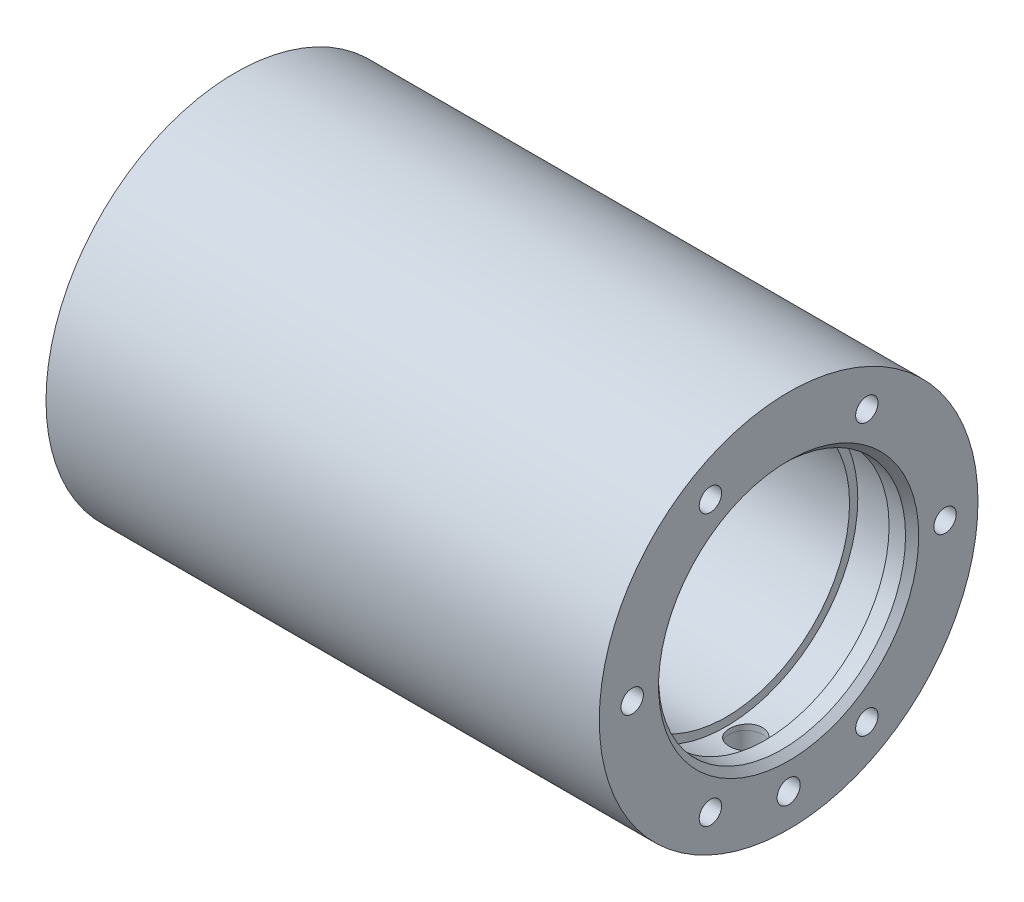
SolidWorks part; units mm, degrees
ref_plane "前视基准面" through (0, 0, 0) normal (0, 0, 1) x (1, 0, 0)
ref_plane "上视基准面" through (0, 0, 0) normal (0, 1, 0) x (1, 0, 0)
ref_plane "右视基准面" through (0, 0, 0) normal (1, 0, 0) x (0, 0, -1)
sketch "草图1" plane through (0, 0, 0) normal (0, 0, 1) x (1, 0, 0)
  line L0 (0, 37.5) -> (16, 37.5)
  line L1 (16, 37.5) -> (16, 40)
  line L2 (16, 40) -> (28, 40)
  line L3 (28, 40) -> (28, 37.5)
  line L4 (28, 37.5) -> (149, 37.5)
  line L5 (149, 37.5) -> (149, 40)
  line L6 (149, 40) -> (161, 40)
  line L7 (161, 40) -> (161, 37.5)
  line L8 (161, 37.5) -> (168, 37.5)
  line L9 (168, 37.5) -> (168, 57.5)
  line L10 (168, 57.5) -> (0, 57.5)
  line L11 (0, 57.5) -> (0, 37.5)
  line L12 (0, 0) -> (-13.8002, 0) construction
  dimension "D1" = 75
  dimension "D2" = 80
  dimension "D3" = 168
  dimension "D4" = 115
  dimension "D5" = 16
  dimension "D6" = 12
  dimension "D7" = 7
  dimension "D8" = 12
revolve "旋转1" add sketch "草图1" angle 360 about L12
chamfer "倒角1" distance 2 angle 45 2 edges at (0, 0, -37.5) (168, 0, -37.5)
sketch "草图2" plane through (0, 0, 0) normal (1, 0, 0) x (0, 0, -1)
  line L0 (0, 0) -> (-6.4772, 0) construction
  circle A0 centre (0, -47.5) radius 3.5
  dimension "D2" = 7
  dimension "D1" = 95
extrude "切除-拉伸2" cut sketch "草图2" along normal blind 22
sketch "草图4" plane through (0, 0, 0) normal (0, 0, 1) x (1, 0, 0)
  line L0 (22, -57.5) -> (22, -76.559) construction
  line L1 (0, -57.5) -> (168, -57.5) construction
  line L2 (16.5, -57.5) -> (17, -41.5)
  line L3 (17, -36.3885) -> (22, -36.3885)
  line L4 (17, -41.5) -> (17, -36.3885)
  line L5 (16.5, -57.5) -> (22, -57.5)
  line L6 (22, -57.5) -> (22, -36.3885)
  line L10 (0, 57.5) -> (0, -57.5) construction
  point P3 (17, -41.5)
  dimension "D1" = 11
  dimension "D2" = 22
  dimension "D3" = 16
  dimension "D4" = 10
revolve "NPT1/4" cut sketch "草图4" angle 360 about L0
sketch "草图5" plane through (0, 0, 0) normal (0, 0, 1) x (1, 0, 0)
  line L0 (155, -13.9183) -> (155, -63.9266) construction
  line L1 (155, -32.6835) -> (155, -57.5)
  line L2 (155, -57.5) -> (160.5, -57.5)
  line L3 (27.5, -57.5) -> (168, -57.5) construction
  line L4 (160.5, -57.5) -> (160, -41.5)
  line L7 (160, -41.5) -> (160, -32.6835)
  line L8 (160, -32.6835) -> (155, -32.6835)
  line L9 (168, -57.5) -> (168, 57.5) construction
  dimension "D1" = 11
  dimension "D2" = 16
  dimension "D3" = 13
  dimension "D4" = 10
revolve "NPT1/4)(2)" cut sketch "草图5" angle 360 about L0
sketch "草图13" plane through (168, 0, 0) normal (1, 0, 0) x (0, 0, -1)
  line L0 (0, 0) -> (-13.0814, 0) construction
  circle A0 centre (0, -47.5) radius 3.5
  dimension "D1" = 7
  dimension "D2" = 95
extrude "切除-拉伸5" cut sketch "草图13" against normal up to surface (9.1711 mm away)
hole_wizard "M8x1.25 螺纹孔2" positions "草图19" profile "草图18" tap size "M8x1.25" standard "Ansi Metric"
sketch "草图19" plane through (0, 0, 0) normal (-1, 0, 0) x (0, 0, 1)
  circle A0 centre (0, 0) radius 47.5 construction
  point P0 (-47.5, 0)
  dimension "D1" = 95
sketch "草图18" plane through (0, 0, -47.5) normal (0, 1, 0) x (0, 0, 1)
  line L0 (0, 0) -> (0, 20.0429)
  line L1 (0, 20.0429) -> (3.4, 18)
  line L2 (3.4, 18) -> (3.4, 0)
  line L5 (3.4, 0) -> (0, 0)
  line L10 (0, 20.0429) -> (-3.4, 18) construction
  line L11 (0, -6.35) -> (0, 107.95) construction
  dimension "蹟恇謂郰芛眻噤" = 6.8
  dimension "蹟恇謂郰芛旮僅" = 18
  dimension "絳芛褒僅" = 118
pattern_circular "阵列(圆周)1" count 6 over 360 about axis through (0, 0, 0) along (1, 0, 0) of "M8x1.25 螺纹孔2"
hole_wizard "M8x1.25 螺纹孔3" positions "草图23" profile "草图22" tap size "M8x1.25" standard "Ansi Metric"
sketch "草图23" plane through (168, 0, 0) normal (1, 0, 0) x (0, 0, -1)
  circle A0 centre (0, 0) radius 47.5 construction
  point P0 (47.5, 0)
sketch "草图22" plane through (168, 0, -47.5) normal (0, 1, 0) x (0, 0, -1)
  line L0 (0, 0) -> (0, 20.0429)
  line L1 (0, 20.0429) -> (3.4, 18)
  line L2 (3.4, 18) -> (3.4, 0)
  line L5 (3.4, 0) -> (0, 0)
  line L10 (0, 20.0429) -> (-3.4, 18) construction
  line L11 (0, -6.35) -> (0, 107.95) construction
  dimension "蹟恇謂郰芛眻噤" = 6.8
  dimension "蹟恇謂郰芛旮僅" = 18
  dimension "絳芛褒僅" = 118
pattern_circular "阵列(圆周)2" count 6 over 360 about axis through (0, 0, 0) along (1, 0, 0) of "M8x1.25 螺纹孔3"
sketch "草图24" plane through (0, 0, 0) normal (-1, 0, 0) x (0, 0, 1)
  line L0 (42.0022, 24.25) -> (-60.1484, -34.7267) construction
  line L1 (0, 0) -> (20.7017, 0) construction
  line L2 (0, 0) -> (7.2765, -12.6032) construction
  point P0 (42.0022, 24.25)
  point P4 (-42.0022, -24.25)
  dimension "D1" = 97
  dimension "D2" = 30
ref_plane "基准面1" through (0, 24.25, 0) normal (0, 1, 0) x (-1, 0, 0)
sketch "草图25" plane through (0, 24.25, 0) normal (0, 1, 0) x (-1, 0, 0)
  line L0 (0, 42.0022) -> (-31.9053, 42.0022)
  line L1 (-30, 38.7022) -> (-31.9053, 42.0022)
  line L2 (-30, 38.7022) -> (0, 37.8022)
  line L3 (0, 42.0022) -> (0, -60.1484) construction
  line L4 (0, 42.0022) -> (6.4659, 42.0022) construction
  line L5 (0, 37.8022) -> (0, 42.0022)
  point P3 (-25, 38.5522)
  dimension "D1" = 8.4
  dimension "D2" = 25
  dimension "D3" = 30
  dimension "D4" = 6.9
  dimension "D5" = 60
revolve "切除-旋转1" cut sketch "草图25" angle 360 about L4
ref_plane "基准面2" through (0, -24.25, 0) normal (0, 1, 0) x (-1, 0, 0)
sketch "草图26" plane through (0, -24.25, 0) normal (0, 1, 0) x (-1, 0, 0)
  line L0 (0, -46.2) -> (-30, -45.3)
  line L1 (0, -57.5) -> (0, 57.5) construction
  line L2 (-30, -45.3) -> (-31.9053, -42)
  line L3 (-31.9053, -42) -> (0, -42)
  line L4 (0, -46.2) -> (0, -42)
  line L7 (8.906, -42) -> (-40.3082, -42) construction
  point P6 (-25, -45.45)
  dimension "D1" = 42
  dimension "D2" = 30
  dimension "D3" = 8.4
  dimension "D4" = 60
  dimension "D5" = 6.9
  dimension "D6" = 25
revolve "切除-旋转2" cut sketch "草图26" angle 360 about L7
sketch "草图27" plane through (0, 0, 0) normal (0, 1, 0) x (1, 0, 0)
  line L0 (-6.7527, 0) -> (172.4588, 0)
extrude "切除-拉伸6" cut sketch "草图27" against normal through all and the other way through all flip side to cut
